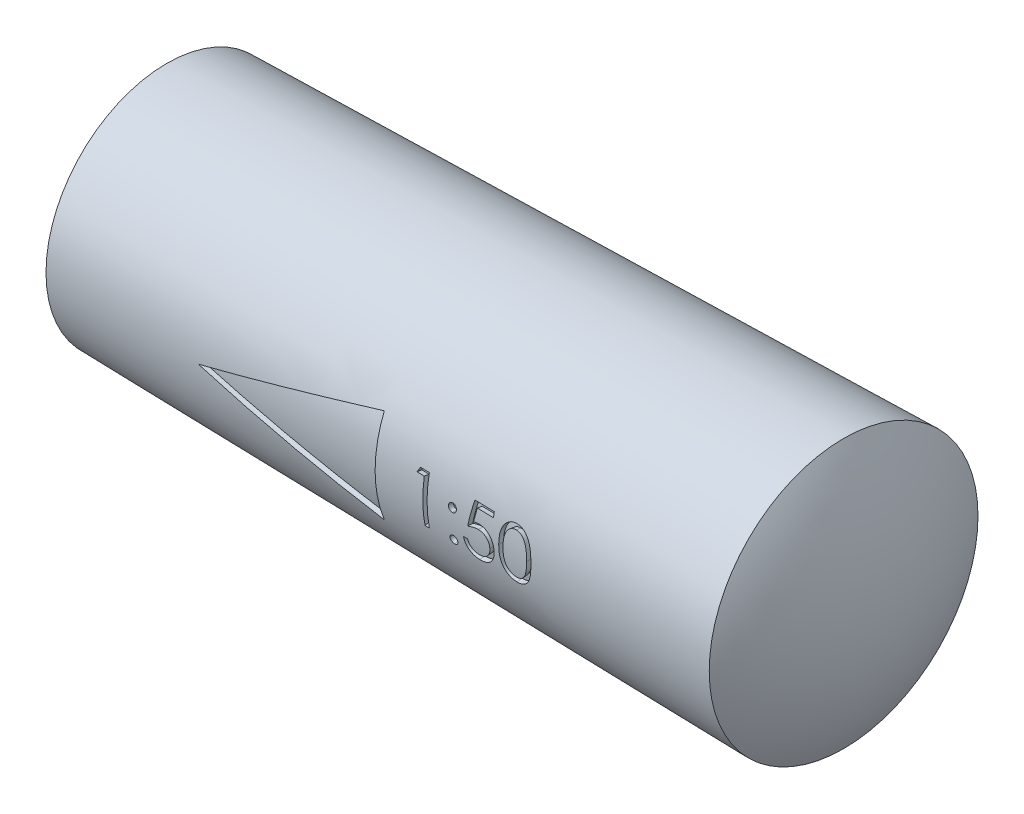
SolidWorks part; units mm, degrees
ref_plane "Front Plane" through (0, 0, 0) normal (0, 0, 1) x (1, 0, 0)
ref_plane "Top Plane" through (0, 0, 0) normal (0, 1, 0) x (1, 0, 0)
ref_plane "Right Plane" through (0, 0, 0) normal (1, 0, 0) x (0, 0, -1)
sketch "Sketch1" plane through (0, 0, 0) normal (1, 0, 0) x (0, 0, -1)
  circle A0 centre (0, 0) radius 2.5
  dimension "D1" = 5
extrude "Extrude1" add sketch "Sketch1" along normal mid plane 14
draft "Draft1" type of draft neutral plane draft angle 1.146 faces to draft 1 parameters "D1"=1.146
sketch "Sketch2" plane through (0, 0, 0) normal (0, 0, 1) x (1, 0, 0)
  line L0 (-7, 0) -> (-7, 2.5)
  line L1 (-7, 2.5) -> (-7, -2.5) construction
  line L2 (-7, 0) -> (-7.75, 0)
  line L3 (-7.75, 0) -> (-7.75, -2.64) construction
  line L4 (7, 0) -> (7, 2.78)
  line L5 (7, -2.78) -> (7, 2.78) construction
  line L6 (7, 0) -> (7.75, 0)
  line L7 (7.75, 0) -> (7.75, -2.64) construction
  line L8 (-7, -2.5) -> (7, -2.78) construction
  arc A0 (-7.75, 0) -> (-7, 2.5) centre (-3.2083, 0) cw
  arc A1 (7.75, 0) -> (7, 2.78) centre (2.2227, 0) ccw
  point P14 (0, -2.64)
revolve "Revolve1" add sketch "Sketch2" angle 360 about L2
sketch "Sketch5" plane through (0, 0, 0) normal (0, 0, 1) x (1, 0, 0)
  line L0 (0, 2.64) -> (0, -2.64) construction
  line L1 (7, 2.78) -> (-7, 2.5) construction
  line L2 (-7, -2.5) -> (7, -2.78) construction
ref_plane "Plane2" through (0, 0, 0) normal (-0.02, 0, 0.9998) x (0.9998, 0, 0.02)
sketch "Sketch6" plane through (0, 0, 0) normal (-0.02, 0, 0.9998) x (0.9998, 0, 0.02)
  line L0 (0, 0) -> (0, 1)
  line L1 (0, 2.64) -> (0, -2.64) construction
  line L2 (0, 1) -> (-3.7321, 0)
  line L3 (-3.7321, 0) -> (0, -1)
  line L4 (0, -1) -> (0, 0)
  line L5 (0, -0.5) -> (4, -0.5) construction
  text T0 "1:50" font "Century Gothic" height 1
  dimension "D1" = 2
  dimension "D2" = 30
  dimension "D3" = 4
wrap "Wrap2" sketch "Sketch6" wrap type deboss source sketch "Sketch6" thickness 0.1 parameters "D1"=0.1
equation "\"D2@Sketch2\" = \"D1@Sketch2\""
